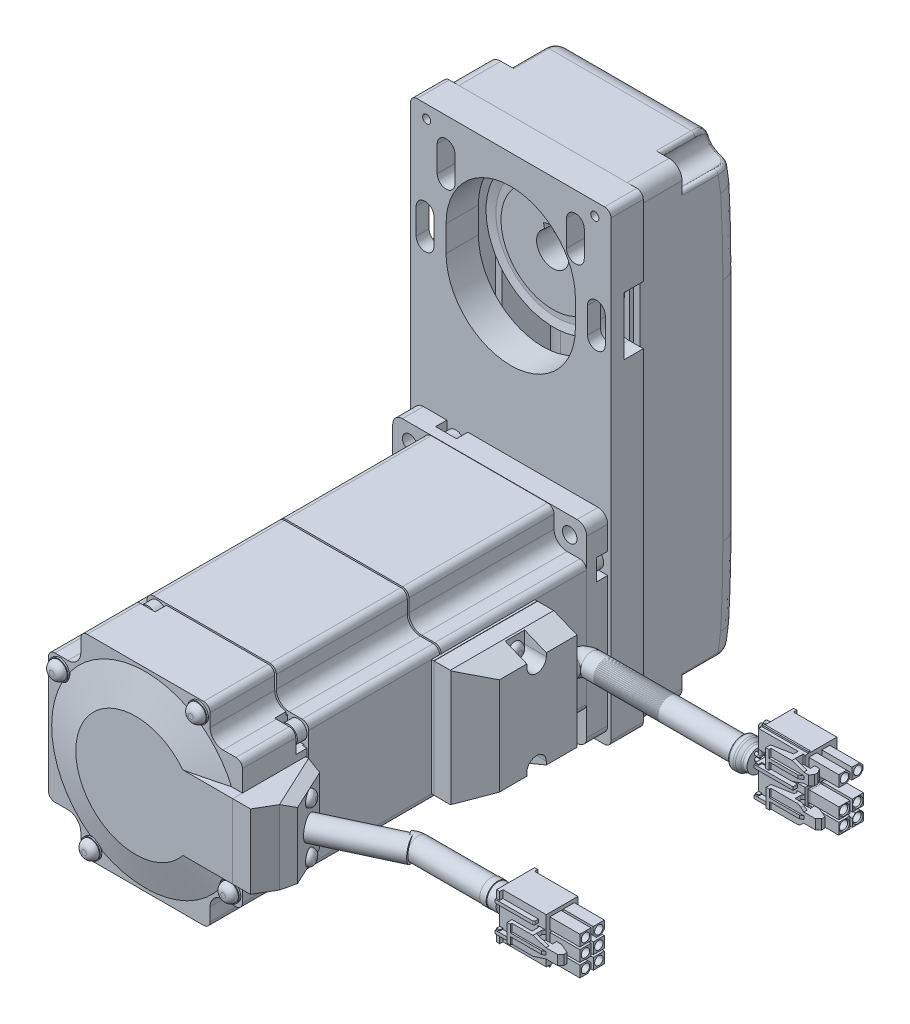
SolidWorks part; units mm, degrees
ref_plane "前视基准面" through (0, 0, 0) normal (0, 0, 1) x (1, 0, 0)
ref_plane "上视基准面" through (0, 0, 0) normal (0, 1, 0) x (1, 0, 0)
ref_plane "右视基准面" through (0, 0, 0) normal (1, 0, 0) x (0, 0, -1)
imported_body "KKU86-HM-P20 下折电机板-1-solid1"
imported_body "伺服电机 MSMD022G1B（200W） 松下-1-surface1"
imported_body "伺服电机 MSMD022G1B（200W） 松下-1-surface2"
imported_body "伺服电机 MSMD022G1B（200W） 松下-1-surface3"
imported_body "伺服电机 MSMD022G1B（200W） 松下-1-surface4"
imported_body "伺服电机 MSMD022G1B（200W） 松下-1-surface5"
imported_body "伺服电机 MSMD022G1B（200W） 松下-1-surface6"
imported_body "伺服电机 MSMD022G1B（200W） 松下-1-surface7"
imported_body "伺服电机 MSMD022G1B（200W） 松下-1-surface8"
imported_body "伺服电机 MSMD022G1B（200W） 松下-1-surface9"
imported_body "伺服电机 MSMD022G1B（200W） 松下-1-surface10"
imported_body "伺服电机 MSMD022G1B（200W） 松下-1-surface11"
imported_body "伺服电机 MSMD022G1B（200W） 松下-1-surface12"
imported_body "伺服电机 MSMD022G1B（200W） 松下-1-surface13"
imported_body "伺服电机 MSMD022G1B（200W） 松下-1-surface14"
imported_body "HTPA40S3M150-A-N10 (外径标准)-1-solid1"
imported_body "HTPA40S3M150-A-N14 (外径标准)-1-solid1"
imported_body "8G-皮带防护罩-1-solid1"
imported_body "皮带1-5^KKU86-HM-P20-1-solid1"
sketch "草图1" plane through (0, 0, 245) normal (0, 0, -1) x (-1, 0, 0)
  line L1 (26.8218, -14.0819) -> (48.2485, -14.0819)
  line L2 (26.8218, -14.0819) -> (26.8218, 38.2886)
  line L3 (26.8218, 38.2886) -> (48.2485, 38.2886)
  line L4 (48.2485, -14.0819) -> (48.2485, 38.2886)
extrude "切除-拉伸1" cut sketch "草图1" along normal blind 10
